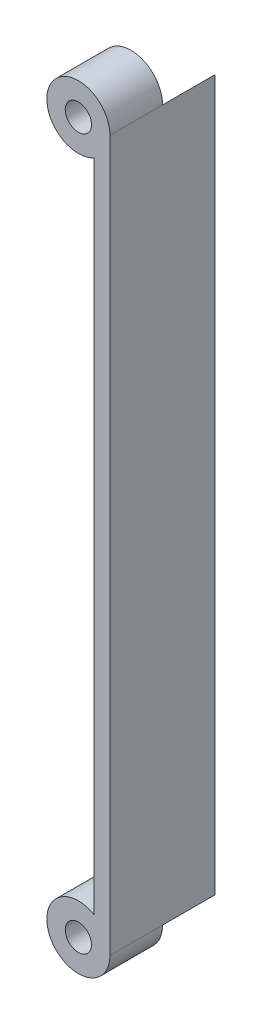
SolidWorks part; units mm, degrees
ref_plane "Plan de face" through (0, 0, 0) normal (0, 0, 1) x (1, 0, 0)
ref_plane "Plan de dessus" through (0, 0, 0) normal (0, 1, 0) x (1, 0, 0)
ref_plane "Plan de droite" through (0, 0, 0) normal (1, 0, 0) x (0, 0, -1)
sketch "Esquisse1" plane through (0, 0, 0) normal (0, 0, 1) x (1, 0, 0)
  line L0 (6, 135) -> (6, 0)
  line L1 (3, 129.8038) -> (3, 5.1962)
  circle A0 centre (0, 0) radius 2.5
  circle A1 centre (0, 135) radius 2.5
  arc A2 (6, 135) -> (3, 129.8038) centre (0, 135) ccw
  arc A3 (3, 5.1962) -> (6, 0) centre (0, 0) ccw
extrude "Boss.-Extru.1" add sketch "Esquisse1" along normal blind 20
sketch "Esquisse2" plane through (0, 0, 0) normal (0, 0, -1) x (-1, 0, 0)
  circle A1 centre (0, 0) radius 6
  circle A2 centre (0, 135) radius 6
  dimension "D1" = 12
  dimension "D2" = 12
extrude "Enlèv. mat.-Extru.1" cut sketch "Esquisse2" against normal blind 10
equation "\"D3@Esquisse1\"=\"D2@Esquisse1\""
